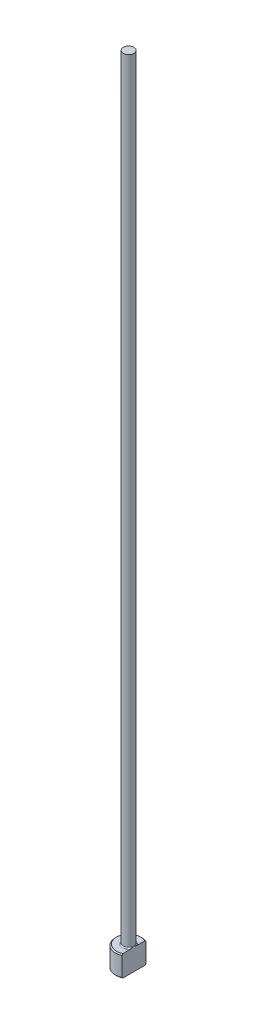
SolidWorks part; units mm, degrees
ref_plane "Front Plane" through (0, 0, 0) normal (0, 0, 1) x (1, 0, 0)
ref_plane "Top Plane" through (0, 0, 0) normal (0, 1, 0) x (1, 0, 0)
ref_plane "Right Plane" through (0, 0, 0) normal (1, 0, 0) x (0, 0, -1)
sketch "Sketch1" plane through (0, 0, 0) normal (0, 0, 1) x (1, 0, 0)
  line L0 (0, 259.9588) -> (0, -15.1925) construction
  line L1 (0, 0) -> (-2.5, 0)
  line L2 (-2.5, 0) -> (-2.5, 4)
  line L3 (-2.5, 4) -> (-1, 4)
  line L4 (-1, 4) -> (-1, 150)
  line L5 (-1, 150) -> (0, 150)
  line L6 (0, 150) -> (0, 0)
  dimension "L" = 150
  dimension "H" = 5
  dimension "T" = 4
  dimension "D" = 2
revolve "Revolve1" add sketch "Sketch1" angle 360 about L0
chamfer "Chamfer1" distance 0.2 angle 45 2 edges at (0, 4, 2.5) (0, 0, 2.5)
fillet "Fillet1" radius 0.2 1 edges at (0, 4, 1)
sketch "Sketch2" plane through (0, 0, 0) normal (0, 1, 0) x (1, 0, 0)
  line L0 (1, -2.2913) -> (1, 2.2913)
  circle A0 centre (0, 0) radius 2.5 construction
  arc A1 (1, -2.2913) -> (1, 2.2913) centre (0, 0) ccw
  circle A2 centre (0, 0) radius 1 construction
extrude "KEYED HEAD" cut sketch "Sketch2" along normal through all
